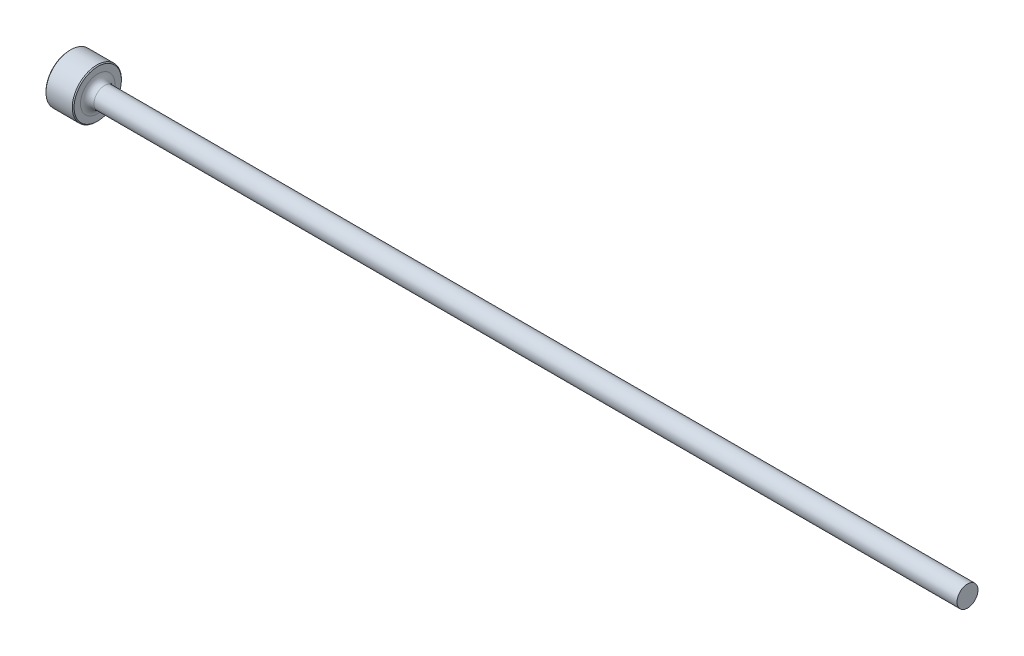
SolidWorks part; units mm, degrees
ref_plane "Front Plane" through (0, 0, 0) normal (0, 0, 1) x (1, 0, 0)
ref_plane "Top Plane" through (0, 0, 0) normal (0, 1, 0) x (1, 0, 0)
ref_plane "Right Plane" through (0, 0, 0) normal (1, 0, 0) x (0, 0, -1)
sketch "Sketch1" plane through (0, 0, 0) normal (0, 0, 1) x (1, 0, 0)
  line L0 (0, 0) -> (0, 2.7781)
  line L1 (0, 2.7781) -> (3.175, 2.7781)
  line L2 (3.175, 2.7781) -> (3.175, 1.9488)
  line L3 (3.937, 1.1868) -> (101.6, 1.1868)
  line L4 (101.6, 1.1868) -> (101.6, 0)
  line L5 (101.6, 0) -> (0, 0)
  line L6 (101.6, 0) -> (101.6, -1.1868) construction
  line L7 (101.6, -1.1868) -> (3.175, -1.1868) construction
  line L8 (0, 0) -> (0, -2.7781) construction
  line L9 (0, -2.7781) -> (3.175, -2.7781) construction
  line L10 (3.175, -2.7781) -> (3.175, -1.1868) construction
  arc A0 (3.175, 1.9488) -> (3.937, 1.1868) centre (3.937, 1.9488) ccw
  dimension "D4" = 0.762
  dimension "L" = 101.6
  dimension "D" = 2.3736
  dimension "H" = 5.5562
  dimension "T" = 3.175
revolve "Revolve1" add sketch "Sketch1" angle 360 about L5
chamfer "Chamfer1" distance 0.1016 angle 45 2 edges at (0, 2.7781, 0) (3.175, 2.7781, 0)
